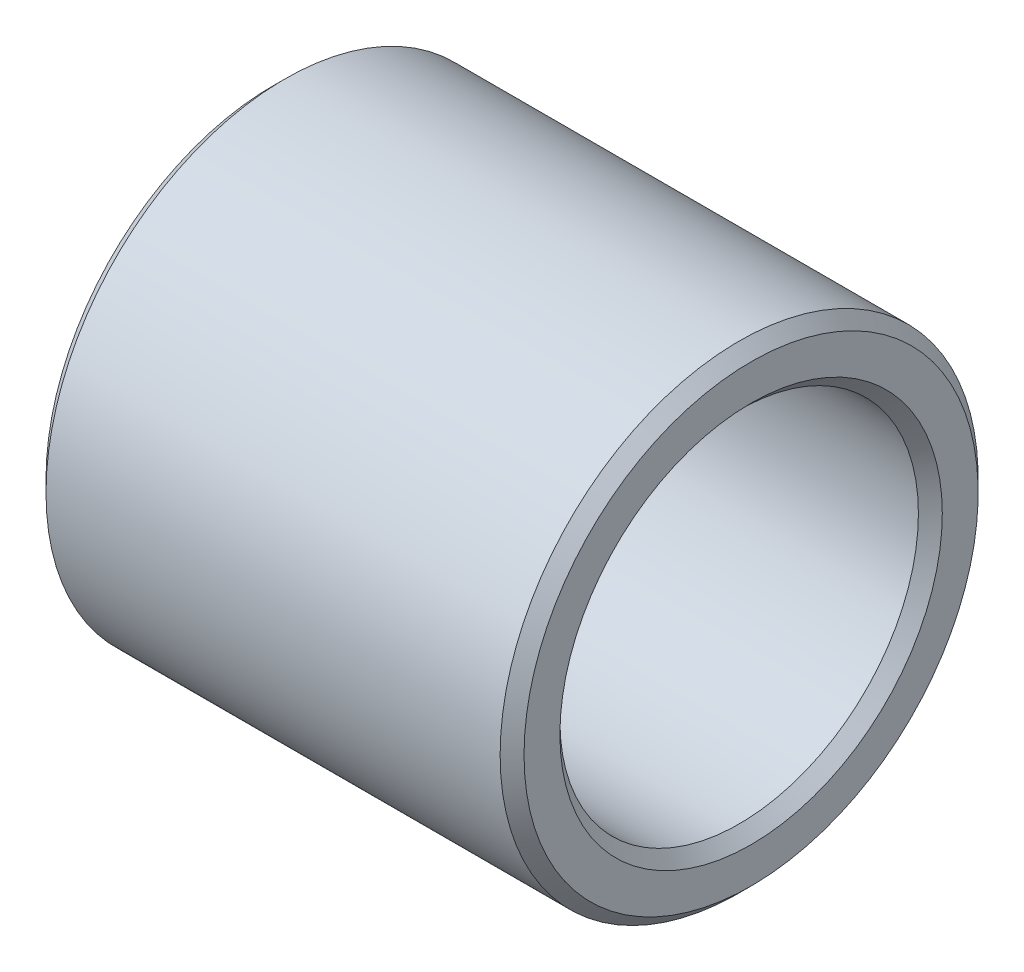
SolidWorks part; units mm, degrees
ref_plane "Plan1" through (0, 0, 0) normal (0, 0, 1) x (1, 0, 0)
ref_plane "Plan2" through (0, 0, 0) normal (0, 1, 0) x (1, 0, 0)
ref_plane "Plan3" through (0, 0, 0) normal (1, 0, 0) x (0, 0, -1)
sketch "Esquisse1" plane through (0, 0, 0) normal (0, 0, 1) x (1, 0, 0)
  line L0 (-8, 6.4) -> (-8, 7.6)
  line L1 (-8, 7.6) -> (-7.6, 8)
  line L2 (-7.6, 8) -> (7.6, 8)
  line L3 (7.6, 8) -> (8, 7.6)
  line L4 (8, 7.6) -> (8, 6.4)
  line L5 (8, 6.4) -> (7.6, 6)
  line L6 (7.6, 6) -> (-7.6, 6)
  line L7 (-7.6, 6) -> (-8, 6.4)
  line L8 (0, 0) -> (8, 0) construction
  point P11 (0, 6)
  dimension "D1" = 6
  dimension "D2" = 8
  dimension "D3" = 16
  dimension "D4" = 45
  dimension "D5" = 45
  dimension "D6" = 45
  dimension "D7" = 45
revolve "Base-Révolution" add sketch "Esquisse1" angle 360 about L8
